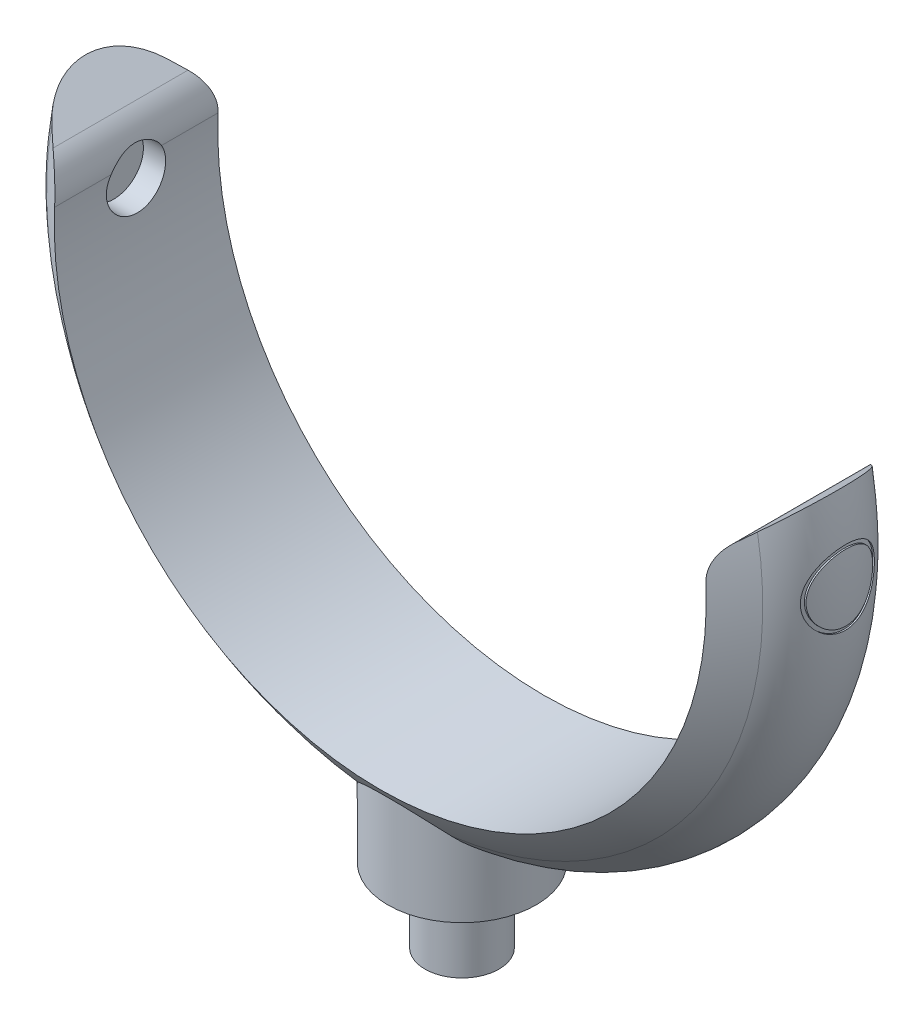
SolidWorks part; units mm, degrees
ref_plane "Спереди" through (0, 0, 0) normal (0, 0, 1) x (1, 0, 0)
ref_plane "Сверху" through (0, 0, 0) normal (0, 1, 0) x (1, 0, 0)
ref_plane "Справа" through (0, 0, 0) normal (1, 0, 0) x (0, 0, -1)
body saved out of another part "Заготовка-Дет3-1"
sketch "Эскиз1" plane through (0, 0, 0) normal (0, 0, 1) x (1, 0, 0)
  line L0 (0, 717.0442) -> (0, -143.6506) construction
  line L1 (-595.8656, 580) -> (566.8534, 580) construction
  line L2 (370, 580) -> (370, 540)
  line L3 (-470, 580) -> (-370, 580)
  line L4 (-470, 580) -> (-470, 540)
  line L5 (-470, 540) -> (-370, 540)
  line L6 (-370, 580) -> (-370, 540)
  line L7 (470, 540) -> (370, 540)
  line L8 (470, 580) -> (470, 540)
  line L9 (470, 580) -> (370, 580)
  dimension "D1" = 40
  dimension "D2" = 470
  dimension "D3" = 100
revolve "Вырез-Повернуть1" cut sketch "Эскиз1" angle 360 about L1
